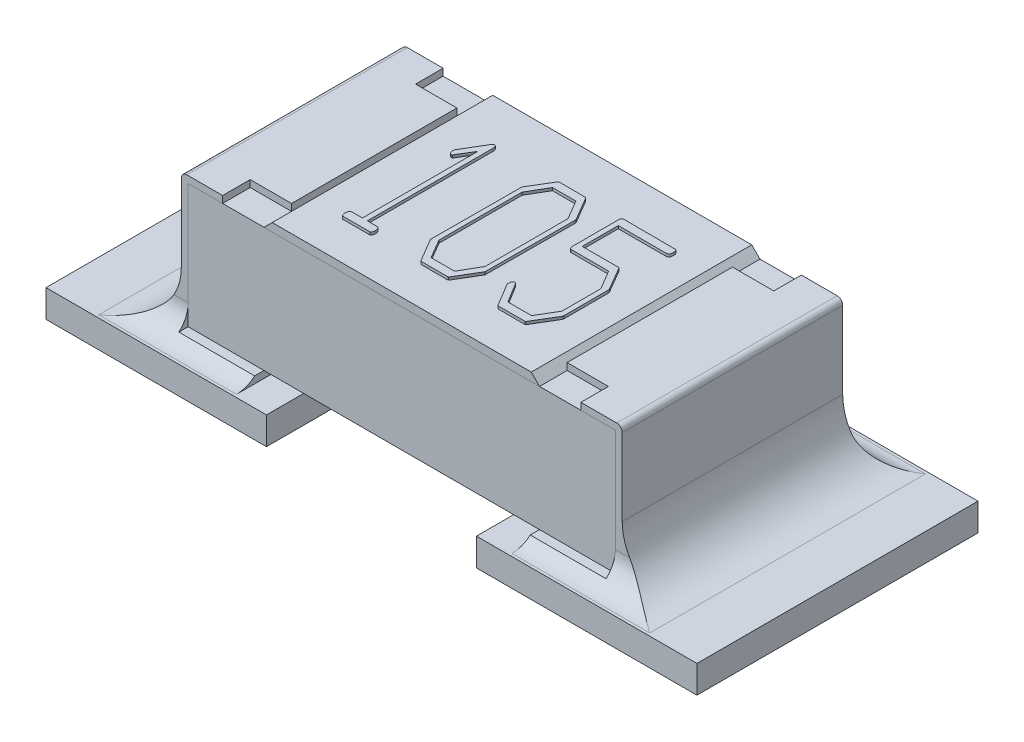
SolidWorks part; units mm, degrees
ref_plane "Front Plane" through (0, 0, 0) normal (0, 0, 1) x (1, 0, 0)
ref_plane "Top Plane" through (0, 0, 0) normal (0, 1, 0) x (1, 0, 0)
ref_plane "Right Plane" through (0, 0, 0) normal (1, 0, 0) x (0, 0, -1)
sketch "Sketch1" plane through (0, 0, 0) normal (1, 0, 0) x (0, 0, -1)
  line L0 (0, 55) -> (0, -55) construction
  line L1 (-0.4, 0.575) -> (0.4, 0.575)
  line L2 (-0.4, 0.575) -> (-0.4, 0.125)
  line L3 (-0.4, 0.125) -> (0.4, 0.125)
  line L4 (0.4, 0.575) -> (0.4, 0.125)
  line L5 (55, 0) -> (-55, 0) construction
  dimension "D1" = 0.8
  dimension "D2" = 0.4
  dimension "D3" = 0.45
  dimension "D4" = 0.125
extrude "Boss-Extrude1" add sketch "Sketch1" along normal mid plane 1.55
sketch "Sketch2" plane through (0, 0, 0) normal (0, 0, 1) x (1, 0, 0)
  line L0 (-0.5, 0.6) -> (-0.78, 0.6)
  line L1 (-0.8, 0.58) -> (-0.8, 0.1)
  line L2 (-0.8, 0.1) -> (-0.5, 0.1)
  line L3 (-0.5, 0.1) -> (-0.5, 0.125)
  line L4 (0.775, 0.125) -> (-0.775, 0.125) construction
  line L5 (-0.5, 0.125) -> (-0.775, 0.125)
  line L6 (-0.775, 0.125) -> (-0.775, 0.575)
  line L7 (-0.775, 0.575) -> (-0.5, 0.575)
  line L8 (0.775, 0.575) -> (-0.775, 0.575) construction
  line L9 (-0.5, 0.575) -> (-0.5, 0.6)
  line L11 (0.5, 0.575) -> (0.5, 0.6)
  line L12 (0.5, 0.6) -> (0.78, 0.6)
  line L13 (0.8, 0.58) -> (0.8, 0.1)
  line L14 (0.8, 0.1) -> (0.5, 0.1)
  line L15 (0.5, 0.1) -> (0.5, 0.125)
  line L16 (0.5, 0.125) -> (0.775, 0.125)
  line L17 (0.775, 0.125) -> (0.775, 0.575)
  line L18 (0.775, 0.575) -> (0.5, 0.575)
  arc A0 (0.78, 0.6) -> (0.8, 0.58) centre (0.78, 0.58) cw
  arc A1 (-0.78, 0.6) -> (-0.8, 0.58) centre (-0.78, 0.58) ccw
  point P28 (-0.8, 0.6)
  dimension "D6" = 0.02
  dimension "D1" = 0.025
  dimension "D2" = 0.025
  dimension "D3" = 0.025
  dimension "D4" = 0.3
  dimension "D5" = 0.3
extrude "Boss-Extrude2" add sketch "Sketch2" along normal mid plane 0.8 separate body
sketch "Sketch3" plane through (0, 0.6, 0) normal (0, 1, 0) x (1, 0, 0)
  line L0 (0.5, -0.4) -> (0.5, 0.4) construction
  line L1 (-0.5, 0.4) -> (-0.65, 0.4)
  line L2 (-0.5, 0.4) -> (-0.5, 0.3)
  line L3 (-0.5, 0.3) -> (-0.65, 0.3)
  line L4 (-0.65, 0.4) -> (-0.65, 0.3)
  line L5 (-0.5, -0.4) -> (-0.65, -0.4)
  line L6 (-0.5, -0.4) -> (-0.5, -0.3)
  line L7 (-0.5, -0.3) -> (-0.65, -0.3)
  line L8 (-0.65, -0.4) -> (-0.65, -0.3)
  line L9 (0.5, -0.4) -> (0.65, -0.4)
  line L10 (0.5, -0.4) -> (0.5, -0.3)
  line L11 (0.5, -0.3) -> (0.65, -0.3)
  line L12 (0.65, -0.4) -> (0.65, -0.3)
  line L13 (0.775, -0.4) -> (-0.775, -0.4) construction
  line L15 (0.5, 0.4) -> (0.65, 0.4)
  line L16 (0.5, 0.4) -> (0.5, 0.3)
  line L17 (0.5, 0.3) -> (0.65, 0.3)
  line L18 (0.65, 0.4) -> (0.65, 0.3)
  dimension "D1" = 0.15
  dimension "D2" = 0.1
extrude "Cut-Extrude1" cut sketch "Sketch3" against normal blind 0.025
sketch "Sketch4" plane through (0, 0, 0) normal (0, 0, 1) x (1, 0, 0)
  line L0 (-0.5, 0.575) -> (0.5, 0.575)
  line L1 (0.5, 0.575) -> (0.47, 0.605)
  line L2 (0.47, 0.605) -> (-0.47, 0.605)
  line L3 (-0.47, 0.605) -> (-0.5, 0.575)
  dimension "D1" = 45
  dimension "D2" = 45
  dimension "D3" = 0.03
extrude "Boss-Extrude3" add sketch "Sketch4" along normal mid plane 0.8 separate body
sketch "Sketch6" plane through (0, 0.605, 0) normal (0, 1, 0) x (1, 0, 0)
  line L0 (-0.4, -0.25) -> (0.4, -0.25) construction
  line L1 (0, -0.2777) -> (0, 0.2777) construction
  line L2 (-0.2777, 0) -> (0.2777, 0) construction
  text T0 "105" font "SWMono" height 0.5
  dimension "D1" = 0.8
  dimension "D2" = 0.4
  dimension "D3" = 0.25
extrude "Boss-Extrude4" add sketch "Sketch6" along normal blind 0.01
sketch "Sketch7" plane through (0, 0, 0) normal (0, 1, 0) x (1, 0, 0)
  line L0 (0, -0.2833) -> (0, 0.2833) construction
  line L1 (-0.381, -0.51) -> (-1.181, -0.51)
  line L2 (-0.381, -0.51) -> (-0.381, 0.51)
  line L3 (-0.381, 0.51) -> (-1.181, 0.51)
  line L4 (-1.181, -0.51) -> (-1.181, 0.51)
  line L5 (0.381, -0.51) -> (1.181, -0.51)
  line L6 (0.381, -0.51) -> (0.381, 0.51)
  line L7 (0.381, 0.51) -> (1.181, 0.51)
  line L8 (1.181, -0.51) -> (1.181, 0.51)
  line L9 (-0.2833, 0) -> (0.2833, 0) construction
  dimension "D1" = 0.8
  dimension "D2" = 0.381
  dimension "D3" = 0.381
  dimension "D4" = 1.02
  dimension "D5" = 0.51
extrude "Boss-Extrude5" add sketch "Sketch7" along normal blind 0.1
fillet "Fillet3" radius 0.2 1 edges at (-0.8, 0.1, 0)
fillet "Fillet4" radius 0.2 1 edges at (0.8, 0.1, 0)
fillet "Fillet5" radius 0.1 2 edges at (0.75, 0.1, -0.4) (0.75, 0.1, 0.4)
fillet "Fillet6" radius 0.1 2 edges at (-0.75, 0.1, 0.4) (-0.75, 0.1, -0.4)
